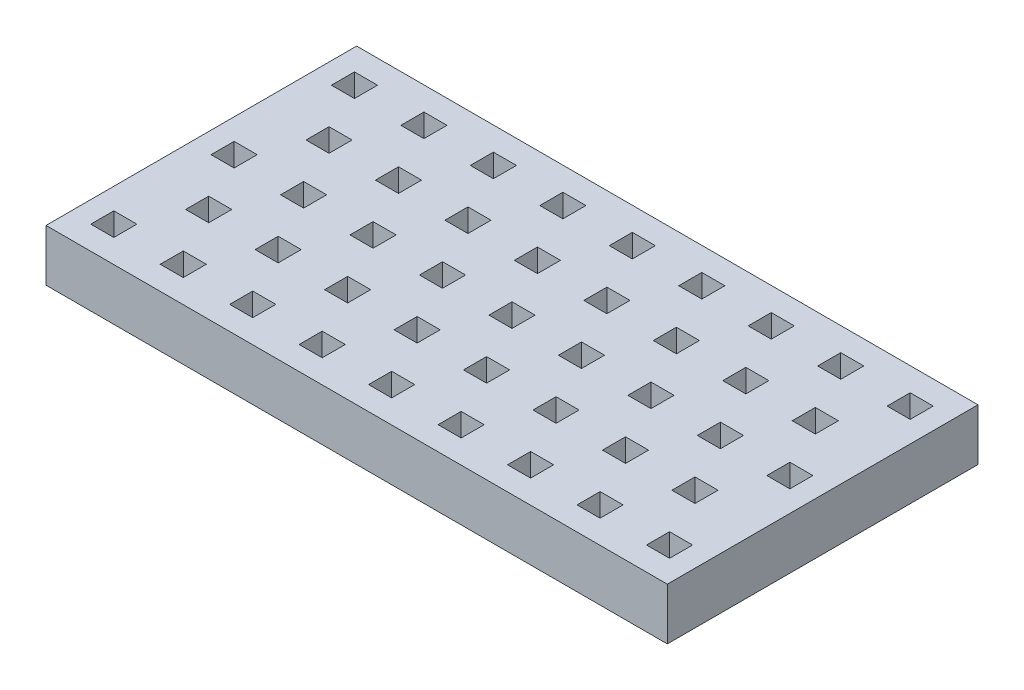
SolidWorks part; units mm, degrees
ref_plane "Front Plane" through (0, 0, 0) normal (0, 0, 1) x (1, 0, 0)
ref_plane "Top Plane" through (0, 0, 0) normal (0, 1, 0) x (1, 0, 0)
ref_plane "Right Plane" through (0, 0, 0) normal (1, 0, 0) x (0, 0, -1)
sketch "Sketch1" plane through (0, 0, 0) normal (0, 1, 0) x (1, 0, 0)
  line L1 (-76.2, 38.1) -> (76.2, 38.1)
  line L2 (-76.2, 38.1) -> (-76.2, -38.1)
  line L3 (-76.2, -38.1) -> (76.2, -38.1)
  line L4 (76.2, 38.1) -> (76.2, -38.1)
  dimension "D1" = 152.4
  dimension "D2" = 76.2
  dimension "D3" = 76.2
  dimension "D4" = 38.1
extrude "Extrude1" add sketch "Sketch1" along normal blind 12.7
other "Fill Pattern3" parameters "D8"=5.6569, "D1"=17.0388, "D2"=60, "D3"=0
